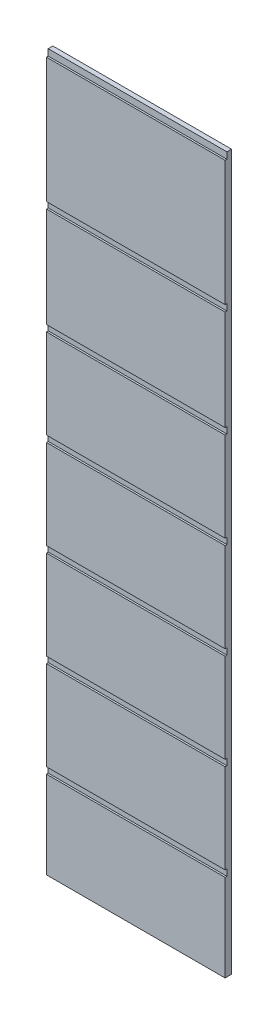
SolidWorks part; units mm, degrees
ref_plane "Plano frontal" through (0, 0, 0) normal (0, 0, 1) x (1, 0, 0)
ref_plane "Plano superior" through (0, 0, 0) normal (0, 1, 0) x (1, 0, 0)
ref_plane "Plano direito" through (0, 0, 0) normal (1, 0, 0) x (0, 0, -1)
sketch "Esboço1" plane through (0, 0, 0) normal (0, 0, 1) x (1, 0, 0)
  line L0 (0, -1000) -> (0, 49000) construction
  line L1 (-1000, 0) -> (49000, 0) construction
  line L2 (-1000, 1000) -> (49000, 1000) construction
  line L3 (-1000, -1000) -> (49000, -1000) construction
  line L4 (250, -1000) -> (250, 49000) construction
  line L5 (-250, -1000) -> (-250, 49000) construction
  line L7 (-250, 1000) -> (250, 1000)
  line L8 (-250, 1000) -> (-250, -1000)
  line L9 (-250, -1000) -> (250, -1000)
  line L10 (250, 1000) -> (250, -1000)
  dimension "D1" = 1000
  dimension "D2" = 1000
  dimension "D3" = 250
  dimension "D4" = 250
extrude "Ressalto-extrusão1" add sketch "Esboço1" along normal mid plane 18
sketch "Esboço2" plane through (0, 0, 9) normal (0, 0, 1) x (1, 0, 0)
  line L0 (-1058.8651, 982) -> (48941.1349, 982) construction
  line L1 (-1058.8651, 1000) -> (48941.1349, 1000) construction
  line L2 (-1058.8651, 334) -> (48941.1349, 334) construction
  line L3 (-938.3318, -1000) -> (49061.6682, -1000) construction
  line L4 (-1058.8651, 316) -> (48941.1349, 316) construction
  line L5 (-1058.8651, 632) -> (48941.1349, 632) construction
  line L6 (-1058.8651, 614) -> (48941.1349, 614) construction
  line L7 (-1058.8651, 66) -> (48941.1349, 66) construction
  line L8 (-1058.8651, 48) -> (48941.1349, 48) construction
  line L9 (-1058.8651, -202) -> (48941.1349, -202) construction
  line L10 (-1058.8651, -220) -> (48941.1349, -220) construction
  line L11 (-1058.8651, -470) -> (48941.1349, -470) construction
  line L12 (-1058.8651, -488) -> (48941.1349, -488) construction
  line L13 (-1058.8651, -738) -> (48941.1349, -738) construction
  line L14 (-1058.8651, -756) -> (48941.1349, -756) construction
  line L15 (-250.1898, -209.5254) -> (-250.1898, 49790.4746) construction
  line L16 (-250, 1000) -> (-250, -1000) construction
  line L17 (250, -201.1161) -> (250, 49798.8839) construction
  line L20 (-250, 1000) -> (250, 1000)
  line L21 (-250, 1000) -> (-250, 982)
  line L22 (-250, 982) -> (250, 982)
  line L23 (250, 1000) -> (250, 982)
  line L24 (-250, 632) -> (250, 632)
  line L25 (-250, 632) -> (-250, 614)
  line L26 (-250, 614) -> (250, 614)
  line L27 (250, 632) -> (250, 614)
  line L28 (-250, 334) -> (250, 334)
  line L29 (-250, 334) -> (-250, 316)
  line L30 (-250, 316) -> (250, 316)
  line L31 (250, 334) -> (250, 316)
  line L32 (-250.1898, 66) -> (250, 66)
  line L33 (-250.1898, 66) -> (-250.1898, 48)
  line L34 (-250.1898, 48) -> (250, 48)
  line L35 (250, 66) -> (250, 48)
  line L36 (-250, -202) -> (250, -202)
  line L37 (-250, -202) -> (-250, -220)
  line L38 (-250, -220) -> (250, -220)
  line L39 (250, -202) -> (250, -220)
  line L40 (-250, -470) -> (250, -470)
  line L41 (-250, -470) -> (-250, -488)
  line L42 (-250, -488) -> (250, -488)
  line L43 (250, -470) -> (250, -488)
  line L44 (-250, -738) -> (250, -738)
  line L45 (-250, -738) -> (-250, -756)
  line L46 (-250, -756) -> (250, -756)
  line L47 (250, -738) -> (250, -756)
  point P63 (-250, 48)
  point P64 (-250.1898, 66)
  point P65 (-250, -220)
  point P68 (-250, -202)
  point P69 (-250, -488)
  point P70 (-250, -470)
  point P71 (-250, -756)
  point P72 (-250, -738)
  dimension "D1" = 350
  dimension "D2" = 280
  dimension "D3" = 250
  dimension "D4" = 250
  dimension "D5" = 250
  dimension "D6" = 18
extrude "Corte-extrusão1" cut sketch "Esboço2" against normal blind 5
